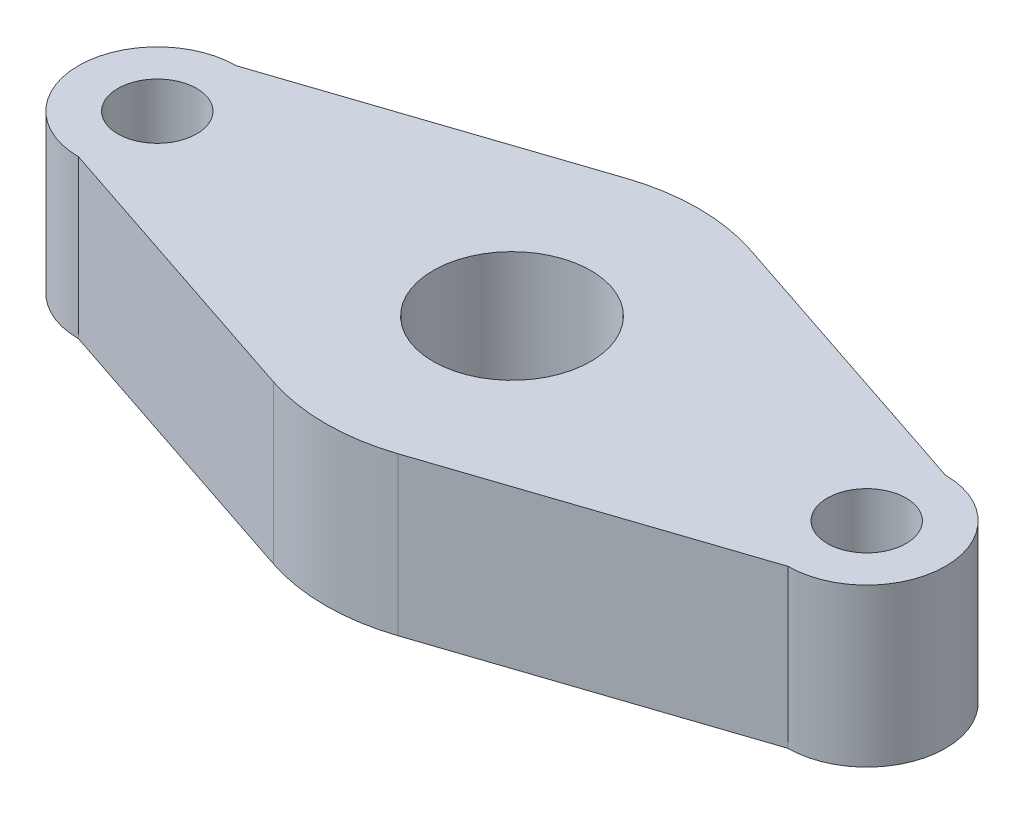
SolidWorks part; units mm, degrees
ref_plane "Front Plane" through (0, 0, 0) normal (0, 0, 1) x (1, 0, 0)
ref_plane "Top Plane" through (0, 0, 0) normal (0, 1, 0) x (1, 0, 0)
ref_plane "Right Plane" through (0, 0, 0) normal (1, 0, 0) x (0, 0, -1)
sketch "Sketch3" plane through (0, 0, 0) normal (0, 1, 0) x (1, 0, 0)
  line L0 (-57.15, 0) -> (57.15, 0) construction
  line L1 (0, -31.75) -> (0, 31.75) construction
  line L2 (10.0402, 28.4033) -> (57.15, 12.7)
  line L3 (-10.0402, 28.4033) -> (-57.15, 12.7)
  line L4 (10.0402, -28.4033) -> (57.15, -12.7)
  line L5 (-10.0402, -28.4033) -> (-57.15, -12.7)
  circle A0 centre (0, 0) radius 12.7
  circle A1 centre (57.15, 0) radius 6.35
  arc A2 (57.15, -12.7) -> (57.15, 12.7) centre (57.15, 0) ccw
  circle A3 centre (-57.15, 0) radius 6.35
  arc A4 (-57.15, -12.7) -> (-57.15, 12.7) centre (-57.15, 0) cw
  arc A5 (-10.0402, 28.4033) -> (10.0402, 28.4033) centre (0, -1.7174) cw
  arc A6 (-10.0402, -28.4033) -> (10.0402, -28.4033) centre (0, 1.7174) ccw
  dimension "D1" = 25.4
  dimension "D2" = 25.4
  dimension "D3" = 12.7
  dimension "D6" = 31.75
  dimension "D4" = 57.15
  dimension "D5" = 31.75
extrude "Boss-Extrude1" add sketch "Sketch3" along normal blind 25.4
